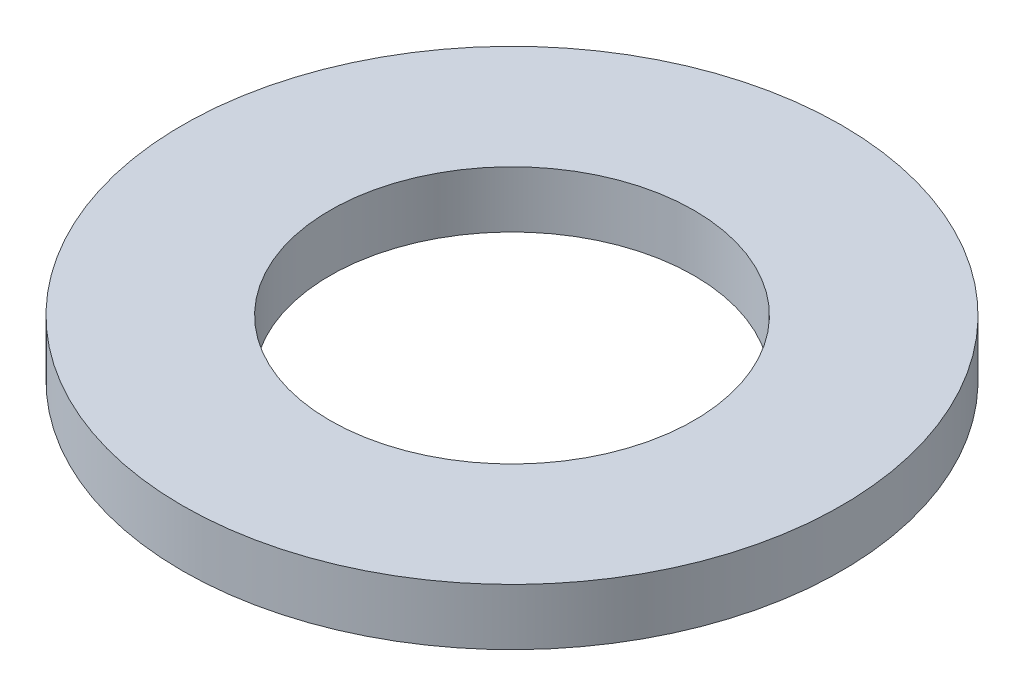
SolidWorks part; units mm, degrees
ref_plane "Front" through (0, 0, 0) normal (0, 0, 1) x (1, 0, 0)
ref_plane "Top" through (0, 0, 0) normal (0, 1, 0) x (1, 0, 0)
ref_plane "Right" through (0, 0, 0) normal (1, 0, 0) x (0, 0, -1)
sketch "Sketch1" plane through (0, 0, 0) normal (0, 1, 0) x (1, 0, 0)
  circle A0 centre (0, 0) radius 29
  circle A1 centre (0, 0) radius 52.5
extrude "Extrude1" add sketch "Sketch1" along normal blind 9
